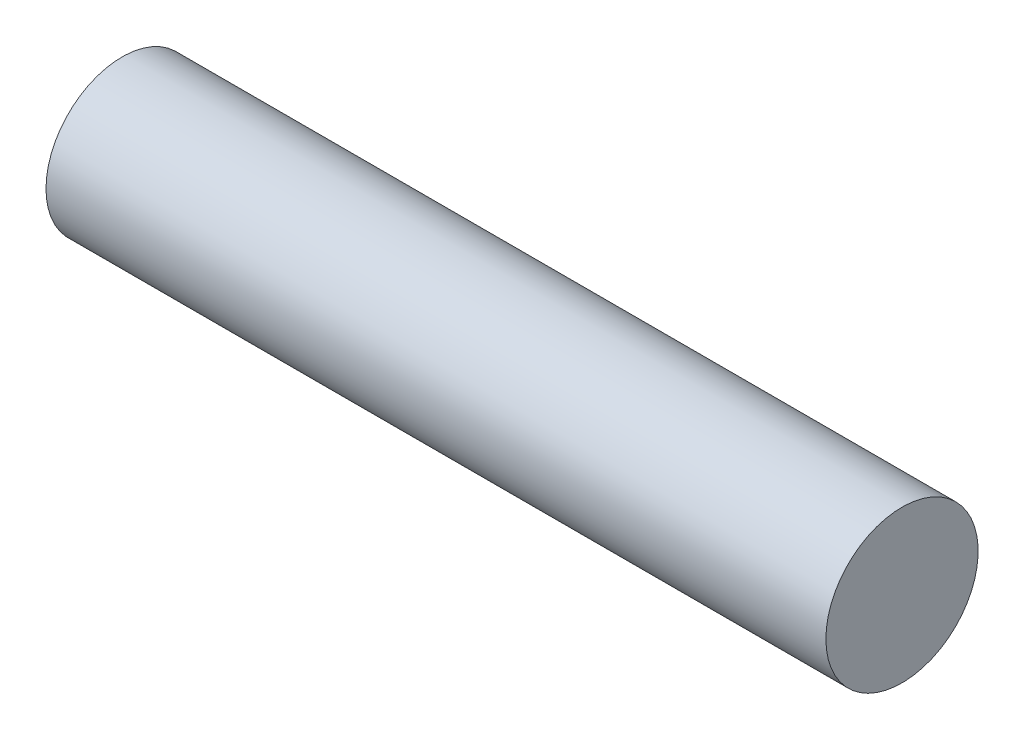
SolidWorks part; units mm, degrees
ref_plane "Front Plane" through (0, 0, 0) normal (0, 0, 1) x (1, 0, 0)
ref_plane "Top Plane" through (0, 0, 0) normal (0, 1, 0) x (1, 0, 0)
ref_plane "Right Plane" through (0, 0, 0) normal (1, 0, 0) x (0, 0, -1)
sketch "Sketch1" plane through (0, 0, 0) normal (1, 0, 0) x (0, 0, -1)
  circle A0 centre (0, 0) radius 2.05
  dimension "D1" = 4.1
extrude "Boss-Extrude1" add sketch "Sketch1" along normal blind 21
